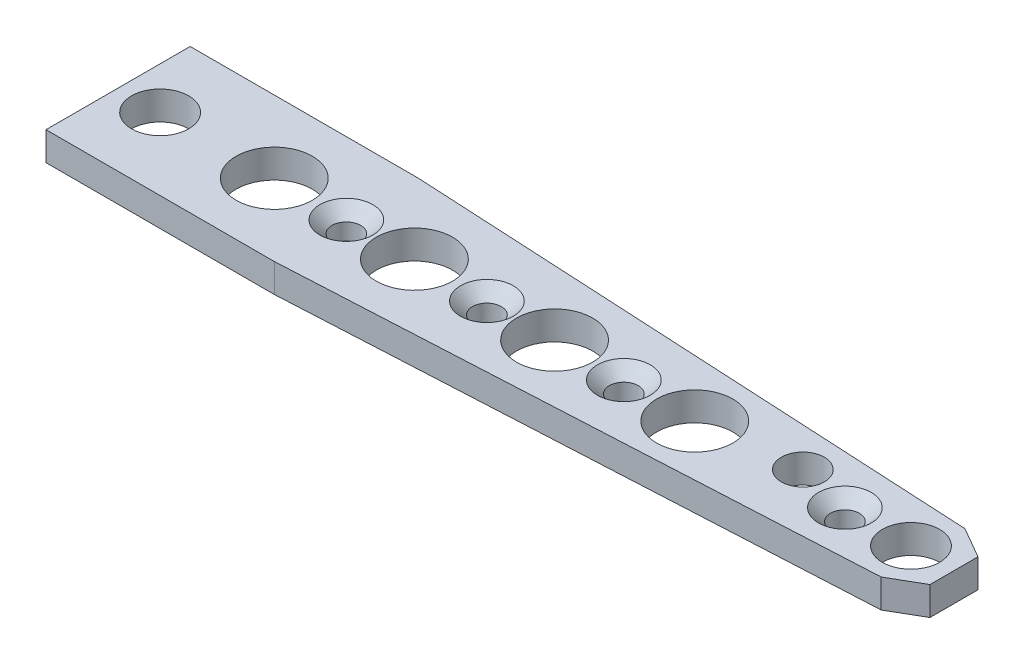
SolidWorks part; units mm, degrees
ref_plane "Front Plane" through (0, 0, 0) normal (0, 0, 1) x (1, 0, 0)
ref_plane "Top Plane" through (0, 0, 0) normal (0, 1, 0) x (1, 0, 0)
ref_plane "Right Plane" through (0, 0, 0) normal (1, 0, 0) x (0, 0, -1)
sketch "Sketch1" plane through (0, 0, 0) normal (0, 1, 0) x (1, 0, 0)
  line L0 (69.58, 3.35) -> (19.015, 6)
  line L1 (0, 6) -> (0, -6)
  line L2 (19.015, -6) -> (69.58, -3.35)
  line L3 (69.58, 3.35) -> (69.58, -3.35)
  line L4 (0, 6) -> (19.015, 6)
  line L5 (0, -6) -> (19.015, -6)
  line L7 (0, -55) -> (0, 55) construction
  line L8 (-55, 0) -> (55, 0) construction
  point P1 (0, 0)
  point P31 (69.58, 0)
  dimension "D2" = 12
  dimension "D3" = 6.7
  dimension "D9" = 6
  dimension "D10" = 69.58
extrude "Boss-Extrude1" add sketch "Sketch1" along normal blind 2.38
hole_wizard "1/4 (0.25) Diameter Hole1" positions "Sketch3" profile "Sketch4" hole size "1/4" standard "ANSI Inch"
sketch "Sketch3" plane through (0, 2.38, 0) normal (0, 1, 0) x (1, 0, 0)
  line L0 (0, -55) -> (0, 55) construction
  line L1 (-55, 0) -> (55, 0) construction
  point P0 (13, 0)
  dimension "D1" = 13
sketch "Sketch4" plane through (13, 2.38, 0) normal (1, 0, 0) x (0, 0, 1)
  line L0 (0, 0) -> (0, 2.38)
  line L1 (0, 2.38) -> (3.175, 2.38)
  line L2 (3.175, 2.38) -> (3.175, 0)
  line L5 (3.175, 0) -> (0, 0)
  line L11 (0, -6.35) -> (0, 107.95) construction
  dimension "Thru Hole Dia." = 6.35
  dimension "Thru Hole Depth" = 2.38
pattern_linear "LPattern1" count 4 spacing 11.667 along (1, 0, 0) of "1/4 (0.25) Diameter Hole1"
hole_wizard "9/64 (0.14063) Diameter Hole1" positions "Sketch6" profile "Sketch5" hole size "9/64" standard "ANSI Inch"
sketch "Sketch6" plane through (0, 2.38, 0) normal (0, 1, 0) x (1, 0, 0)
  line L0 (0, -55) -> (0, 55) construction
  line L1 (-55, 0) -> (55, 0) construction
  point P0 (56, 1)
  dimension "D1" = 56
  dimension "D2" = 1
sketch "Sketch5" plane through (56, 2.38, -1) normal (1, 0, 0) x (0, 0, 1)
  line L0 (0, 0) -> (0, 2.38)
  line L1 (0, 2.38) -> (1.786, 2.38)
  line L2 (1.786, 2.38) -> (1.786, 0)
  line L5 (1.786, 0) -> (0, 0)
  line L11 (0, -6.35) -> (0, 107.95) construction
  dimension "Thru Hole Dia." = 3.572
  dimension "Thru Hole Depth" = 2.38
hole_wizard "CSK for M2 Flat Head Machine Screw1" positions "Sketch8" profile "Sketch9" countersink size "M2" standard "ANSI Metric"
sketch "Sketch8" plane through (0, 2.38, 0) normal (0, 1, 0) x (1, 0, 0)
  line L0 (0, 6) -> (0, -6) construction
  point P0 (19, 0)
  point P3 (30.7, 0)
  point P6 (42.1, 0)
  point P9 (60.5, 0)
  dimension "D1" = 19
  dimension "D2" = 30.7
  dimension "D3" = 42.1
  dimension "D4" = 60.5
sketch "Sketch9" plane through (19, 2.38, 0) normal (1, 0, 0) x (0, 0, 1)
  line L0 (0, 0) -> (0, 2.38)
  line L1 (0, 2.38) -> (1.2, 2.38)
  line L2 (1.2, 2.38) -> (1.2, 1)
  line L3 (1.2, 1) -> (2.2, 0)
  line L5 (2.2, 0) -> (0, 0)
  line L6 (-1.2, 1) -> (-2.2, 0) construction
  line L11 (0, -6.35) -> (0, 107.95) construction
  dimension "Thru Hole Dia." = 2.4
  dimension "Thru Hole Depth" = 2.38
  dimension "Near C'Sink Dia." = 4.4
  dimension "Near C'Sink Angle" = 90
chamfer "Chamfer1" distance 1.35 angle 60 2 edges at (69.58, 1.19, -3.35) (69.58, 1.19, 3.35)
hole_wizard "3/16 (0.1875) Diameter Hole1" positions "Sketch15" profile "Sketch14" hole size "3/16" standard "ANSI Inch"
sketch "Sketch15" plane through (0, 2.38, 0) normal (0, 1, 0) x (1, 0, 0)
  line L0 (0, 6) -> (0, -6) construction
  point P0 (3.5, 0)
  point P2 (66, 0)
  dimension "D1" = 62.5
  dimension "D2" = 3.5
sketch "Sketch14" plane through (3.5, 2.38, 0) normal (1, 0, 0) x (0, 0, 1)
  line L0 (0, 0) -> (0, 2.38)
  line L1 (0, 2.38) -> (2.3812, 2.38)
  line L2 (2.3812, 2.38) -> (2.3812, 0)
  line L5 (2.3812, 0) -> (0, 0)
  line L11 (0, -6.35) -> (0, 107.95) construction
  dimension "Thru Hole Dia." = 4.7625
  dimension "Thru Hole Depth" = 2.38
sketch "Sketch16" plane through (0, 0, 0) normal (0, -1, 0) x (1, 0, 0)
  line L1 (69.58, 2) -> (67.0083, 3.4848) construction
  line L2 (69.58, 2) -> (67.0083, 3.4848) construction
  line L3 (69.58, 2) -> (69.58, -2) construction
  line L4 (69.58, 2) -> (69.58, -2) construction
  circle A0 centre (66, 0) radius 2.3813 construction
  point P6 (73.0441, 0)
  point P7 (0, 0)
  dimension "D4" = 3.58
  dimension "D1" = 60
  dimension "D5" = 2
